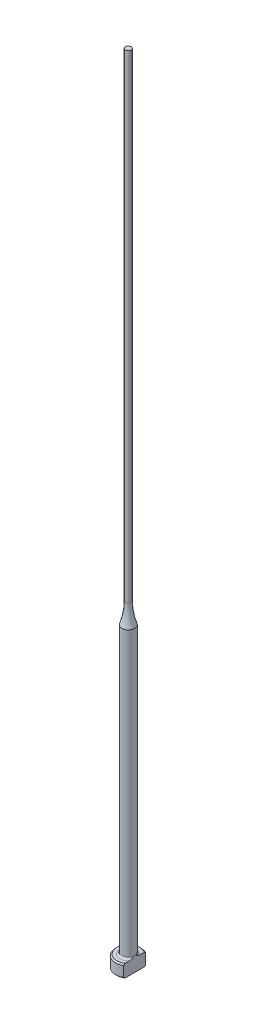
SolidWorks part; units mm, degrees
ref_plane "Front Plane" through (0, 0, 0) normal (0, 0, 1) x (1, 0, 0)
ref_plane "Top Plane" through (0, 0, 0) normal (0, 1, 0) x (1, 0, 0)
ref_plane "Right Plane" through (0, 0, 0) normal (1, 0, 0) x (0, 0, -1)
sketch "Sketch1" plane through (0, 0, 0) normal (0, 0, 1) x (1, 0, 0)
  line L0 (0, 259.9588) -> (0, -15.1925) construction
  line L1 (0, 0) -> (-2, 0)
  line L2 (-2, 0) -> (-2, 2)
  line L3 (-2, 2) -> (-1, 2)
  line L4 (-0.45, 50) -> (-0.45, 125)
  line L5 (-0.45, 125) -> (0, 125)
  line L6 (0, 125) -> (0, 0)
  line L7 (-1, 2) -> (-1, 46.7293)
  arc A0 (-1, 46.7293) -> (-0.45, 50) centre (-10.45, 50) ccw
  point P13 (-1, 0)
  dimension "D1" = 10
  dimension "L" = 125
  dimension "H" = 4
  dimension "T" = 2
  dimension "D" = 0.9
  dimension "B" = 2
  dimension "S" = 50
revolve "Revolve1" add sketch "Sketch1" angle 360 about L0
chamfer "Chamfer1" distance 0.2 angle 45 2 edges at (0, 2, 2) (0, 0, 2)
fillet "Fillet1" radius 0.3 1 edges at (0, 2, 1)
sketch "Sketch2" plane through (0, 0, 0) normal (0, 1, 0) x (1, 0, 0)
  line L0 (1, 1.7321) -> (1, -1.7321)
  circle A0 centre (0, 0) radius 2 construction
  arc A1 (1, -1.7321) -> (1, 1.7321) centre (0, 0) ccw
  circle A2 centre (0, 0) radius 1 construction
extrude "KEY" cut sketch "Sketch2" along normal through all
